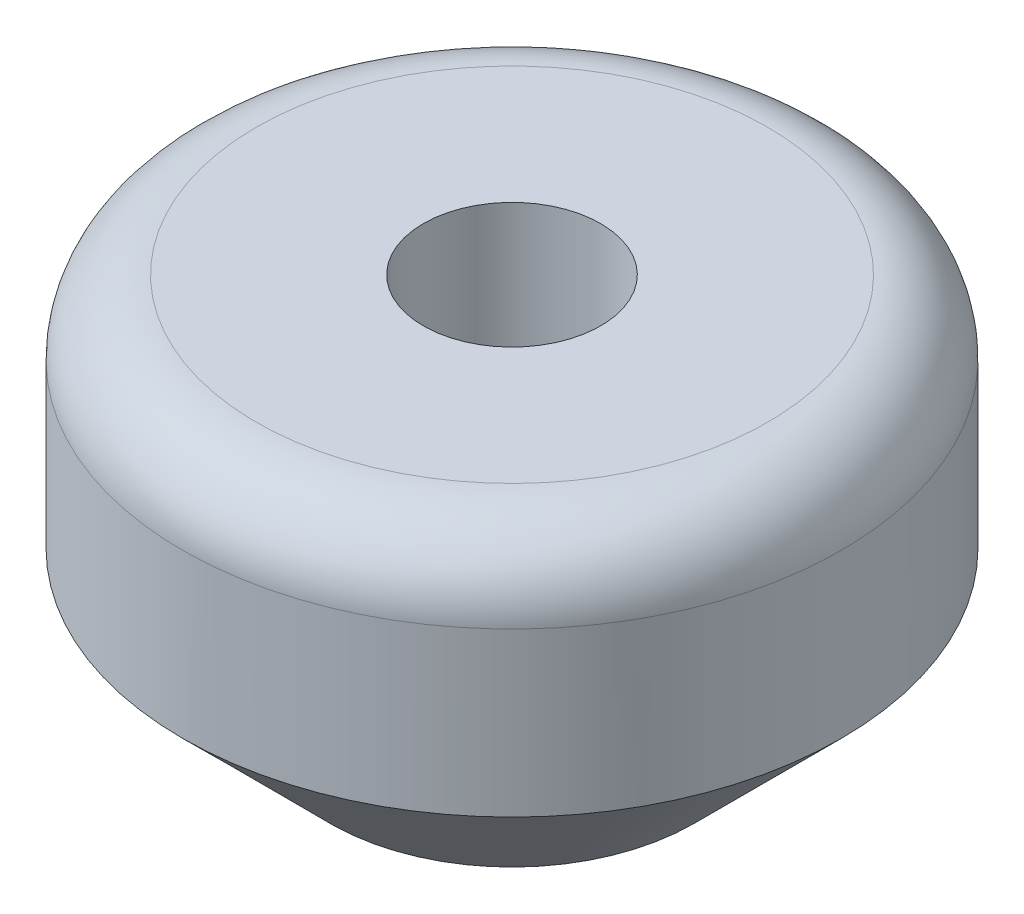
SolidWorks part; units mm, degrees
ref_plane "Face" through (0, 0, 0) normal (0, 0, 1) x (1, 0, 0)
ref_plane "Dessus" through (0, 0, 0) normal (0, 1, 0) x (1, 0, 0)
ref_plane "Droite" through (0, 0, 0) normal (1, 0, 0) x (0, 0, -1)
sketch "Esquisse1" plane through (0, 0, 0) normal (0, 0, 1) x (1, 0, 0)
  line L2 (-8, -133.5075) -> (-8, -120.3003)
  line L3 (0, -83.163) -> (0, -153.6454) construction
  line L4 (0, -25.5) -> (0, -37.5) construction
  line L5 (-12, -81.463) -> (-44.603, -81.463)
  line L6 (-44.603, -81.463) -> (-44.603, -133.5075)
  line L7 (-44.603, -133.5075) -> (-8, -133.5075)
  line L8 (-8, -119.5) -> (-8, -136) construction
  line L9 (-8, -120.3003) -> (-12, -99.5)
  line L10 (-12, -99.5) -> (-8, -119.5) construction
  line L11 (-12, -99.5) -> (-12, -81.463)
revolve "Base-Révolution" add sketch "Esquisse1" angle 360 about L3
chamfer "Chanfrein1" distance 20 angle 45
fillet "Congé1" radius 10
